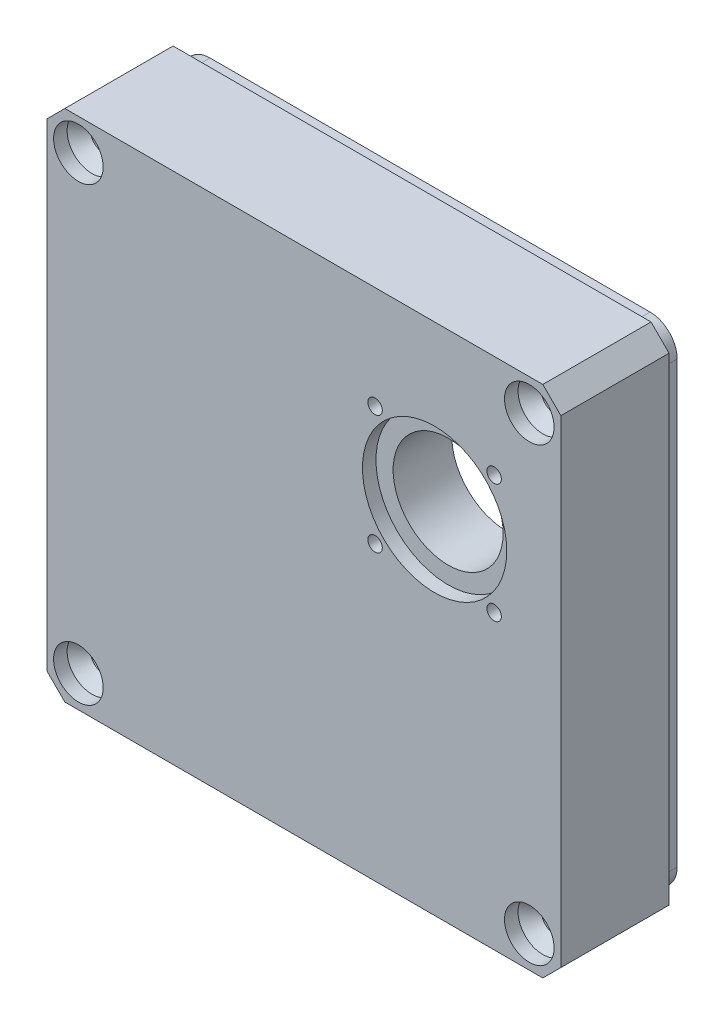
SolidWorks part; units mm, degrees
ref_plane "Front" through (0, 0, 0) normal (0, 0, 1) x (1, 0, 0)
ref_plane "Top" through (0, 0, 0) normal (0, 1, 0) x (1, 0, 0)
ref_plane "Right" through (0, 0, 0) normal (1, 0, 0) x (0, 0, -1)
sketch "Эскиз1" plane through (0, 0, 0) normal (0, 0, 1) x (1, 0, 0)
  line L0 (-28.5, 26.5) -> (-26.5, 28.5)
  line L1 (-26.5, -28.5) -> (26.5, -28.5)
  line L2 (-28.5, -26.5) -> (-28.5, 26.5)
  line L3 (-26.5, 28.5) -> (26.5, 28.5)
  line L4 (28.5, -26.5) -> (28.5, 26.5)
  line L5 (-28.5, -28.5) -> (28.5, 28.5) construction
  line L6 (-28.5, 28.5) -> (28.5, -28.5) construction
  line L7 (-26.5, -28.5) -> (-28.5, -26.5)
  line L8 (26.5, -28.5) -> (28.5, -26.5)
  line L9 (28.5, 26.5) -> (26.5, 28.5)
  point P0 (0, 0)
  dimension "D1" = 57
  dimension "D2" = 57
extrude "Бобышка-Вытянуть1" add sketch "Эскиз1" along normal blind 14
sketch "Эскиз2" plane through (0, 0, 0) normal (0, 0, -1) x (-1, 0, 0)
  line L0 (-26.5, -28.5) -> (-28.5, -26.5)
  line L1 (-24.4, -27.4) -> (24.4, -27.4)
  line L2 (-27.4, -24.4) -> (-27.4, 24.4)
  line L3 (-24.4, 27.4) -> (24.4, 27.4)
  line L4 (27.4, -24.4) -> (27.4, 24.4)
  line L5 (-27.4, -27.4) -> (27.4, 27.4) construction
  line L6 (-27.4, 27.4) -> (27.4, -27.4) construction
  line L7 (-28.5, -26.5) -> (-28.5, 26.5)
  line L8 (-28.5, 26.5) -> (-26.5, 28.5)
  line L9 (-26.5, 28.5) -> (26.5, 28.5)
  line L10 (26.5, 28.5) -> (28.5, 26.5)
  line L11 (28.5, 26.5) -> (28.5, -26.5)
  line L12 (28.5, -26.5) -> (26.5, -28.5)
  line L13 (26.5, -28.5) -> (-26.5, -28.5)
  arc A0 (27.4, -24.4) -> (24.4, -27.4) centre (24.4, -24.4) cw
  arc A1 (-24.4, -27.4) -> (-27.4, -24.4) centre (-24.4, -24.4) cw
  arc A2 (27.4, 24.4) -> (24.4, 27.4) centre (24.4, 24.4) ccw
  arc A3 (-24.4, 27.4) -> (-27.4, 24.4) centre (-24.4, 24.4) ccw
  point P0 (0, 0)
  dimension "D3" = 3
  dimension "D1" = 54.8
  dimension "D2" = 54.8
extrude "Вырез-Вытянуть1" cut sketch "Эскиз2" against normal blind 2
sketch "Эскиз6" plane through (0, 0, 0) normal (0, 0, -1) x (-1, 0, 0)
  line L0 (-28.5, 26.5) -> (-28.5, -26.5) construction
  line L1 (26.5, 28.5) -> (-26.5, 28.5) construction
  circle A0 centre (-14.5, 10.5) radius 6.1
  dimension "D1" = 12.2
  dimension "D2" = 14
  dimension "D3" = 18
extrude "Вырез-Вытянуть3" cut sketch "Эскиз6" against normal through all
hole_wizard "Отверстие обработанное метчиком M21" positions "Эскиз9" profile "Эскиз10" tap size "M2" standard "DIN"
sketch "Эскиз9" plane through (0, 0, 14) normal (0, 0, 1) x (1, 0, 0)
  circle A0 centre (14.5, 10.5) radius 6.1 construction
  point P0 (7.9, 3.9)
  point P2 (7.9, 17.1)
  point P4 (21.1, 17.1)
  point P6 (21.1, 3.9)
  dimension "D4" = 6.6
  dimension "D1" = 6.6
  dimension "D2" = 13.2
  dimension "D3" = 13.2
sketch "Эскиз10" plane through (7.9, 3.9, 14) normal (1, 0, 0) x (0, -1, 0)
  line L0 (0, 0) -> (0, 6.9807)
  line L1 (0, 6.9807) -> (0.8, 6.5)
  line L2 (0.8, 6.5) -> (0.8, 0)
  line L5 (0.8, 0) -> (0, 0)
  line L10 (0, 6.9807) -> (-0.8, 6.5) construction
  line L11 (0, -6.35) -> (0, 107.95) construction
  dimension "Диаметр сверла" = 1.6
  dimension "Глубина сверла" = 6.5
  dimension "Угол заточки сверла" = 118
sketch "Эскиз11" plane through (0, 0, 0) normal (0, 0, -1) x (-1, 0, 0)
  line L1 (-23.5, -23.5) -> (23.5, -23.5)
  line L2 (-23.5, -23.5) -> (-23.5, 23.5)
  line L3 (-23.5, 23.5) -> (23.5, 23.5)
  line L4 (23.5, -23.5) -> (23.5, 23.5)
  line L5 (-23.5, -23.5) -> (23.5, 23.5) construction
  line L6 (-23.5, 23.5) -> (23.5, -23.5) construction
  point P0 (0, 0)
  dimension "D1" = 47
  dimension "D2" = 47
extrude "Вырез-Вытянуть4" cut sketch "Эскиз11" against normal blind 6
chamfer "Фаска1" distance 5 angle 45 4 edges at (-23.5, -23.5, 3) (23.5, 23.5, 3) (23.5, -23.5, 3) (-23.5, 23.5, 3)
fillet "Скругление1" radius 4 8 edges at (-23.5, 18.5, 3) (-18.5, 23.5, 3) (-23.5, -18.5, 3) (-18.5, -23.5, 3) (18.5, -23.5, 3) (23.5, -18.5, 3) (23.5, 18.5, 3) (18.5, 23.5, 3)
sketch "Эскиз12" plane through (0, 0, 14) normal (0, 0, 1) x (1, 0, 0)
  circle A0 centre (14.5, 10.5) radius 8
  circle A1 centre (14.5, 10.5) radius 6
  dimension "D1" = 16
  dimension "D2" = 12
extrude "Вырез-Вытянуть5" cut sketch "Эскиз12" against normal blind 1.5
sketch "Эскиз15" plane through (0, 0, 6) normal (0, 0, -1) x (-1, 0, 0)
  line L0 (-23.5, 16.8431) -> (-23.5, -16.8431) construction
  line L1 (-19.6716, -22.3284) -> (-22.3284, -19.6716) construction
  line L2 (-16.8431, -23.5) -> (16.8431, -23.5) construction
  line L3 (22.3284, -19.6716) -> (19.6716, -22.3284) construction
  line L4 (23.5, -16.8431) -> (23.5, 16.8431) construction
  line L5 (19.6716, 22.3284) -> (22.3284, 19.6716) construction
  line L6 (16.8431, 23.5) -> (-16.8431, 23.5) construction
  line L7 (-23.5, -9.5) -> (-23.5, -16.8431)
  line L8 (-19.6716, -22.3284) -> (-22.3284, -19.6716)
  line L9 (-16.8431, -23.5) -> (16.8431, -23.5)
  line L10 (22.3284, -19.6716) -> (19.6716, -22.3284)
  line L11 (23.5, -16.8431) -> (23.5, 16.8431)
  line L12 (19.6716, 22.3284) -> (22.3284, 19.6716)
  line L13 (16.8431, 23.5) -> (-1.5, 23.5)
  line L14 (-5.5, 19.5) -> (-5.5, -5.5)
  line L15 (-5.5, -5.5) -> (-19.5, -5.5)
  arc A0 (-23.5, -16.8431) -> (-22.3284, -19.6716) centre (-19.5, -16.8431) ccw construction
  arc A1 (-19.6716, -22.3284) -> (-16.8431, -23.5) centre (-16.8431, -19.5) ccw construction
  arc A2 (16.8431, -23.5) -> (19.6716, -22.3284) centre (16.8431, -19.5) ccw construction
  arc A3 (22.3284, -19.6716) -> (23.5, -16.8431) centre (19.5, -16.8431) ccw construction
  arc A4 (23.5, 16.8431) -> (22.3284, 19.6716) centre (19.5, 16.8431) ccw construction
  arc A5 (19.6716, 22.3284) -> (16.8431, 23.5) centre (16.8431, 19.5) ccw construction
  arc A6 (-23.5, -16.8431) -> (-22.3284, -19.6716) centre (-19.5, -16.8431) ccw
  arc A7 (-19.6716, -22.3284) -> (-16.8431, -23.5) centre (-16.8431, -19.5) ccw
  arc A8 (16.8431, -23.5) -> (19.6716, -22.3284) centre (16.8431, -19.5) ccw
  arc A9 (22.3284, -19.6716) -> (23.5, -16.8431) centre (19.5, -16.8431) ccw
  arc A10 (23.5, 16.8431) -> (22.3284, 19.6716) centre (19.5, 16.8431) ccw
  arc A11 (19.6716, 22.3284) -> (16.8431, 23.5) centre (16.8431, 19.5) ccw
  arc A12 (-23.5, -9.5) -> (-19.5, -5.5) centre (-19.5, -9.5) cw
  arc A13 (-1.5, 23.5) -> (-5.5, 19.5) centre (-1.5, 19.5) ccw
  dimension "D3" = 4
  dimension "D1" = 18
  dimension "D2" = 29
extrude "Вырез-Вытянуть6" cut sketch "Эскиз15" against normal blind 5
hole_wizard "Зенковка для винта с полупотайной головкой M2.51" positions "Эскиз18" profile "Эскиз19" countersink size "M2.5" standard "ISO"
sketch "Эскиз18" plane through (0, 0, 14) normal (0, 0, 1) x (1, 0, 0)
  line L0 (27.5, 27.5) -> (-27.5, -27.5) construction
  line L1 (28.5, 26.5) -> (26.5, 28.5) construction
  line L2 (-28.5, -26.5) -> (-26.5, -28.5) construction
  line L4 (-27.5, 27.5) -> (27.5, -27.5) construction
  line L5 (-26.5, 28.5) -> (-28.5, 26.5) construction
  line L6 (26.5, -28.5) -> (28.5, -26.5) construction
  point P0 (-25, 25)
  point P2 (25, 25)
  point P4 (25, -25)
  point P6 (-25, -25)
  dimension "D1" = 50
  dimension "D2" = 25
  dimension "D3" = 50
sketch "Эскиз19" plane through (-25, 25, 14) normal (1, 0, 0) x (0, -1, 0)
  line L0 (0, 0) -> (0, 14)
  line L1 (0, 14) -> (1.45, 14)
  line L2 (1.45, 14) -> (1.45, 1.3)
  line L3 (1.45, 1.3) -> (2.75, 0)
  line L5 (2.75, 0) -> (0, 0)
  line L6 (-1.45, 1.3) -> (-2.75, 0) construction
  line L11 (0, -6.35) -> (0, 107.95) construction
  dimension "Диаметр сквозного отверстия" = 2.9
  dimension "Глубина сквозного отверстия" = 14
  dimension "Диаметр передней зенковки" = 5.5
  dimension "Угол передней зенковки" = 90
hole_wizard "Отверстие обработанное метчиком M2.51" positions "Эскиз21" profile "Эскиз22" tap size "M2.5" standard "ISO"
sketch "Эскиз21" plane through (0, 0, 6) normal (0, 0, -1) x (-1, 0, 0)
  line L0 (-28.5, 26.5) -> (-28.5, -26.5) construction
  line L1 (-26.5, -28.5) -> (26.5, -28.5) construction
  point P0 (-10, -0.5)
  dimension "D1" = 18.5
  dimension "D2" = 28
sketch "Эскиз22" plane through (10, -0.5, 6) normal (1, 0, 0) x (0, 1, 0)
  line L0 (0, 0) -> (0, 7.1159)
  line L1 (0, 7.1159) -> (1.025, 6.5)
  line L2 (1.025, 6.5) -> (1.025, 0)
  line L5 (1.025, 0) -> (0, 0)
  line L10 (0, 7.1159) -> (-1.025, 6.5) construction
  line L11 (0, -6.35) -> (0, 107.95) construction
  dimension "Диаметр сверла" = 2.05
  dimension "Глубина сверла" = 6.5
  dimension "Угол заточки сверла" = 118
hole_wizard "Диаметр отверстия Ø5.5 (5.5)1" positions "Эскиз25" profile "Эскиз26" hole size "Ø5.5" standard "ISO"
sketch "Эскиз25" plane through (0, 0, 14) normal (0, 0, 1) x (1, 0, 0)
  point P0 (-25, 25)
  point P3 (-25, -25)
  point P6 (25, -25)
  point P9 (25, 25)
sketch "Эскиз26" plane through (-25, 25, 14) normal (1, 0, 0) x (0, -1, 0)
  line L0 (0, 0) -> (0, 4.25)
  line L1 (0, 4.25) -> (2.75, 1.5)
  line L2 (2.75, 1.5) -> (2.75, 0)
  line L5 (2.75, 0) -> (0, 0)
  line L10 (0, 4.25) -> (-2.75, 1.5) construction
  line L11 (0, -6.35) -> (0, 107.95) construction
  dimension "Диаметр отверстия" = 5.5
  dimension "Глубина отверстия" = 1.5
  dimension "Угол заточки сверла" = 90
